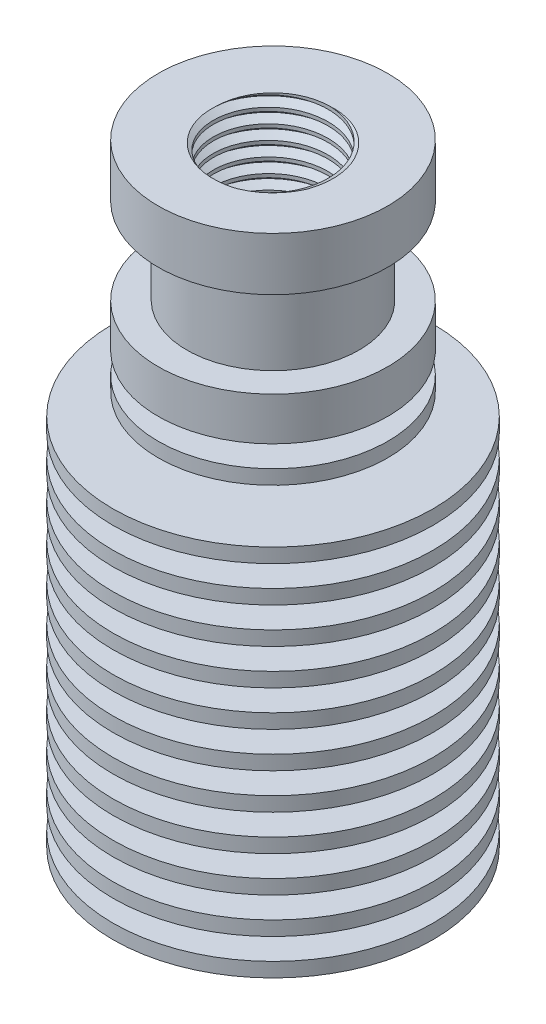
SolidWorks part; units mm, degrees
ref_plane "Front Plane" through (0, 0, 0) normal (0, 0, 1) x (1, 0, 0)
ref_plane "Top Plane" through (0, 0, 0) normal (0, 1, 0) x (1, 0, 0)
ref_plane "Right Plane" through (0, 0, 0) normal (1, 0, 0) x (0, 0, -1)
sketch "Sketch1" plane through (0, 0, 0) normal (1, 0, 0) x (0, 0, -1)
  line L0 (6, 0) -> (4, 30)
  line L1 (3, 0) -> (8, 0)
  line L2 (0, 0) -> (0, 42.7)
  line L3 (4, 42.7) -> (8, 42.7)
  line L4 (8, 30) -> (8, 42.7)
  line L5 (3, 0) -> (15.3401, 0)
  line L6 (0, 0) -> (0, 42.7)
  line L7 (0, 42.7) -> (-27.196, 42.7)
  line L9 (4, 42.7) -> (8, 42.7)
  line L10 (0, 42.7) -> (0, 39)
  line L11 (0, 39) -> (2.1, 39) construction
  line L12 (8, 42.7) -> (8, 39)
  line L13 (0, 39) -> (2.1, 39) construction
  line L14 (0, 39) -> (0, 33)
  line L15 (2.1, 33) -> (6, 33) construction
  line L16 (6, 39) -> (6, 33)
  line L17 (6, 33) -> (8, 33)
  line L18 (0, 33) -> (0, 30)
  line L19 (4, 30) -> (8, 30)
  line L20 (8, 33) -> (8, 30)
  line L21 (0, 30) -> (2.1, 30) construction
  line L22 (0, 0) -> (2.1, 0) construction
  line L23 (0, 0) -> (0, 42.7)
  line L24 (0, 42.7) -> (2.1, 42.7) construction
  line L25 (2.1, 15.1) -> (2.1, 30)
  line L26 (2.1, 0) -> (3, 0) construction
  line L27 (0, 0) -> (0, 15.1)
  line L28 (2.1, 15.1) -> (3, 15.1) construction
  line L29 (3, 0) -> (3, 14.2)
  line L30 (0, 33) -> (2.1, 33) construction
  line L31 (0, 33) -> (2.1, 33) construction
  line L32 (2.1, 33) -> (2.1, 34.3)
  line L33 (2.1, 39) -> (2.1, 42.7) construction
  line L34 (2.1, 39) -> (6, 39) construction
  line L35 (6, 39) -> (8, 39)
  line L36 (2.1, 39) -> (6, 39) construction
  line L37 (2.1, 33) -> (6, 33) construction
  line L38 (2.1, 30) -> (2.1, 33)
  line L39 (0, 15.1) -> (2.1, 15.1) construction
  line L40 (2.1, 0) -> (2.1, 15.1) construction
  line L41 (4, 36.2) -> (2.1, 34.3)
  line L42 (2.1, 42.7) -> (4, 42.7) construction
  line L43 (0, 42.7) -> (0, 36.2)
  line L44 (2.1, 36.2) -> (4, 36.2) construction
  line L45 (4, 42.7) -> (4, 36.2)
  line L46 (2.1, 36.2) -> (2.1, 39) construction
  line L47 (0, 36.2) -> (2.1, 36.2) construction
  line L48 (2.1, 34.3) -> (2.1, 36.2) construction
  line L49 (2.1, 15.1) -> (3, 14.2)
  line L50 (2.1, 30) -> (4, 30) construction
  line L51 (3, 14.2) -> (3, 15.1) construction
  line L52 (0, 42.7) -> (2.1, 42.7) construction
  line L53 (0, 42.7) -> (2.1, 42.7) construction
  line L54 (0, 42.7) -> (2.1, 42.7) construction
  line L55 (2.1, 42.7) -> (4, 42.7) construction
  line L56 (2.1, 42.7) -> (4, 42.7) construction
  line L57 (0, 0) -> (2.1, 0) construction
  line L58 (0, 0) -> (2.1, 0) construction
  line L59 (0, 0) -> (2.1, 0) construction
  line L60 (2.1, 0) -> (3, 0) construction
  line L61 (2.1, 0) -> (3, 0) construction
  line L62 (8, 0) -> (8, 30) construction
  dimension "D1" = 42.7
  dimension "D2" = 3.7
  dimension "D3" = 6
  dimension "D4" = 3
  dimension "D5" = 6
  dimension "D6" = 8
  dimension "D7" = 6
  dimension "D8" = 4
  dimension "D9" = 2.1
  dimension "D10" = 3
  dimension "D11" = 15.1
  dimension "D12" = 4
  dimension "D13" = 6.5
  dimension "D14" = 45
  dimension "D15" = 135
  dimension "D16" = 15.3401
  dimension "D17" = 27.196
revolve "Revolve1" add sketch "Sketch1" angle 360 about L2
ref_plane "Plane1" through (0, 26, 0) normal (0, -1, 0) x (-1, 0, 0)
sketch "Sketch2" plane through (0, 26, 0) normal (0, -1, 0) x (-1, 0, 0)
  circle A0 centre (0, 0) radius 11.15
  circle A1 centre (0, 0) radius 4
  dimension "D1" = 22.3
  dimension "D2" = 8
extrude "Boss-Extrude1" add sketch "Sketch2" along normal blind 1 contours A0 | A1
pattern_linear "LPattern2" count 11 spacing 2.5 along (0, -1, 0) of "Boss-Extrude1"
sketch "Sketch3" plane through (0, 0, 0) normal (1, 0, 0) x (0, 0, -1)
  line L0 (2.1, 15.1) -> (2.1, 30) construction
  line L1 (2.1, 15.1) -> (3, 14.2) construction
  line L2 (3, 0) -> (3, 14.2) construction
  line L3 (2.1, 15.1) -> (2.1, 30)
  line L4 (2.1, 15.1) -> (3, 14.2)
  line L5 (3, 0) -> (3, 14.2)
  line L6 (0, 0) -> (3, 0)
  line L7 (0, 0) -> (0, 30)
  line L8 (0, 30) -> (2.1, 30)
revolve "Cut-Revolve1" cut sketch "Sketch3" angle 360 about L7
ref_plane "Plane2" through (0, 28.5, 0) normal (0, 1, 0) x (1, 0, 0)
sketch "Sketch4" plane through (0, 28.5, 0) normal (0, 1, 0) x (1, 0, 0)
  circle A0 centre (0, 0) radius 8
  circle A1 centre (0, 0) radius 8
  circle A2 centre (0, 0) radius 8
  circle A3 centre (0, 0) radius 3.5
  dimension "D2" = 7
  dimension "D3" = 16
  dimension "D1" = 0
extrude "Boss-Extrude2" add sketch "Sketch4" against normal blind 1 contours A0 A3
thread "Thread1" pitch 1 start angle 0, offset 1, length 0, pitch 1, diameter 6
ref_plane "Plane3" through (3, -1, 0) normal (0, 0, 1) x (1, 0, 0)
sketch "Thread Profile1" plane through (3, -1, 0) normal (0, 0, 1) x (1, 0, 0)
  line L0 (0, 0) -> (0, 1) construction
  line L1 (0, 0) -> (0.5413, 0.3125)
  line L2 (0.5413, 0.3125) -> (0.5413, 0.4375)
  line L3 (0.5413, 0.4375) -> (0, 0.75)
  line L4 (0.5413, 0.375) -> (0, 0.375) construction
  line L11 (0, 0) -> (0, 0.75)
  point P2 (0, 0)
  dimension "Pitch" = 1
  dimension "Profile_Angle" = 60
  dimension "Profile_Land" = 0.125
  dimension "Profile_Height" = 0.5413
thread "Thread2" pitch 1 start angle 0, offset 1, length 0, pitch 1, diameter 8
ref_plane "Plane4" through (-4, 43.7, 0) normal (0, 0, 1) x (-1, 0, 0)
sketch "Thread Profile2" plane through (-4, 43.7, 0) normal (0, 0, 1) x (-1, 0, 0)
  line L0 (0, 0) -> (0, 1) construction
  line L1 (0, 0) -> (0.5413, 0.3125)
  line L2 (0.5413, 0.3125) -> (0.5413, 0.4375)
  line L3 (0.5413, 0.4375) -> (0, 0.75)
  line L4 (0.5413, 0.375) -> (0, 0.375) construction
  line L11 (0, 0) -> (0, 0.75)
  point P2 (0, 0)
  dimension "Pitch" = 1
  dimension "Profile_Angle" = 60
  dimension "Profile_Land" = 0.125
  dimension "Profile_Height" = 0.5413
